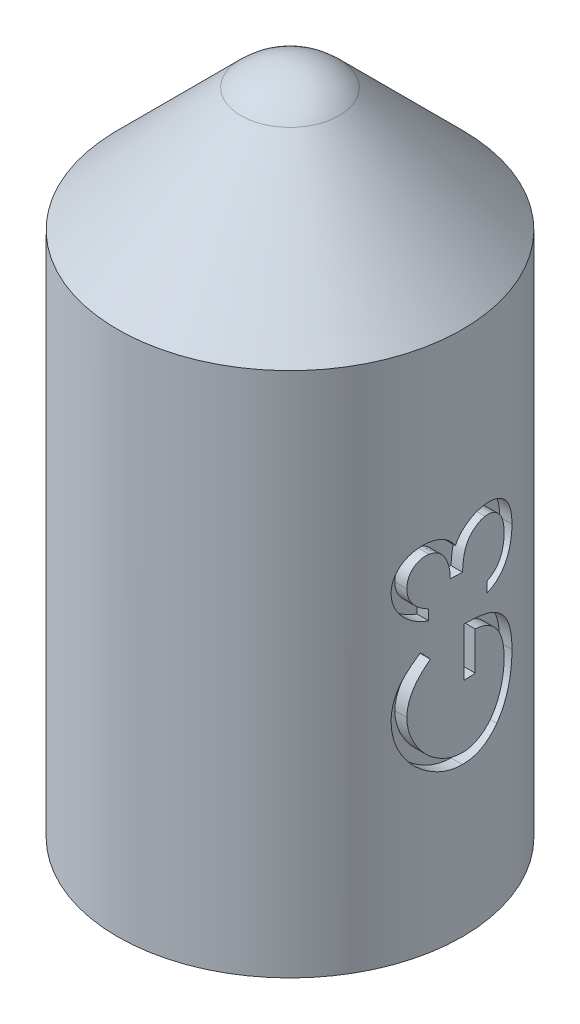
SolidWorks part; units mm, degrees
ref_plane "Plan de face" through (0, 0, 0) normal (0, 0, 1) x (1, 0, 0)
ref_plane "Plan de dessus" through (0, 0, 0) normal (0, 1, 0) x (1, 0, 0)
ref_plane "Plan de droite" through (0, 0, 0) normal (1, 0, 0) x (0, 0, -1)
sketch "Esquisse1" plane through (0, 0, 0) normal (0, 0, 1) x (1, 0, 0)
  line L0 (0, 0) -> (0, 61.7034) construction
  line L1 (-1.5, 4.75) -> (-1.5, 0.1754)
  line L2 (-1.5, 4.75) -> (0, 6.25) construction
  line L3 (-1, 5.25) -> (0, 5.25) construction
  line L4 (0, 0) -> (0, 6)
  line L5 (-1.5, 4.75) -> (-0.4268, 5.8232)
  arc A0 (-1.5, 0.1754) -> (0, 0) centre (0, 6.5) ccw
  arc A1 (0, 6) -> (-0.4268, 5.8232) centre (0, 5.3964) ccw
  dimension "D2" = 13
  dimension "D1" = 3
  dimension "D3" = 45
  dimension "D4" = 2
  dimension "D5" = 1.25
  dimension "D6" = 0.25
revolve "Révolution1" add sketch "Esquisse1" angle 360 about L0
ref_plane "Plan1" through (1.5, 0, 0) normal (1, 0, 0) x (0, 0, -1)
sketch "Esquisse2" plane through (1.5, 0, 0) normal (1, 0, 0) x (0, 0, -1)
  line L0 (0.5, 0) -> (0.5, 4.766) construction
  text T0 "G3" font "Century Gothic" height 1
  dimension "D1" = 0.5
extrude "Enlèv. mat.-Extru.1" cut sketch "Esquisse2" against normal offset from surface (0.1 mm away) 0.1
ref_plane "Plan2" through (-1.5, 0, 0) normal (-1, 0, 0) x (0, 0, 1)
sketch "Esquisse3" plane through (-1.5, 0, 0) normal (-1, 0, 0) x (0, 0, 1)
  line L0 (0.5, 4.75) -> (0.5, 0) construction
  line L1 (-1.5, 4.75) -> (1.5, 4.75) construction
  text T0 "G3" font "Century Gothic" height 1
  dimension "D1" = 0.5
extrude "Enlèv. mat.-Extru.2" cut sketch "Esquisse3" against normal offset from surface (0.1255 mm away) 0.1
